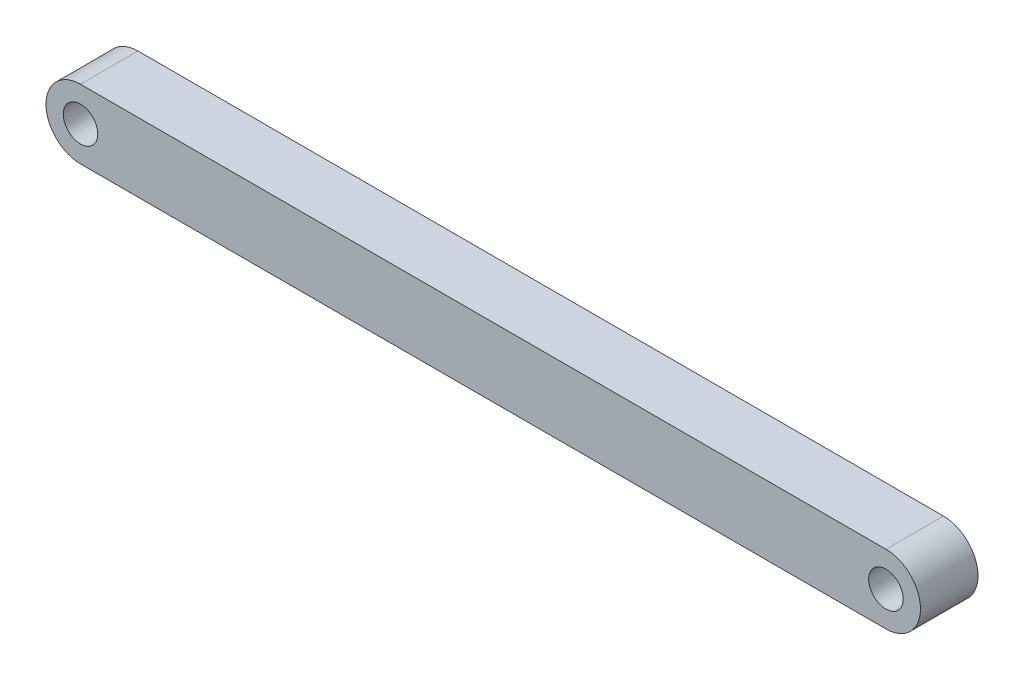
SolidWorks part; units mm, degrees
ref_plane "Front Plane" through (0, 0, 0) normal (0, 0, 1) x (1, 0, 0)
ref_plane "Top Plane" through (0, 0, 0) normal (0, 1, 0) x (1, 0, 0)
ref_plane "Right Plane" through (0, 0, 0) normal (1, 0, 0) x (0, 0, -1)
sketch "Sketch1"
sketch_block_instance "Block-Connecting Rod1-1"
sketch_block "Block-Connecting Rod1"
sketch_block_instance "Block-Connecting rod-2"
sketch_block "Block1" parameters "D2"=3, "D3"=3, "D1"=70
extrude "Boss-Extrude1" add sketch "Sketch1" along normal blind 5
